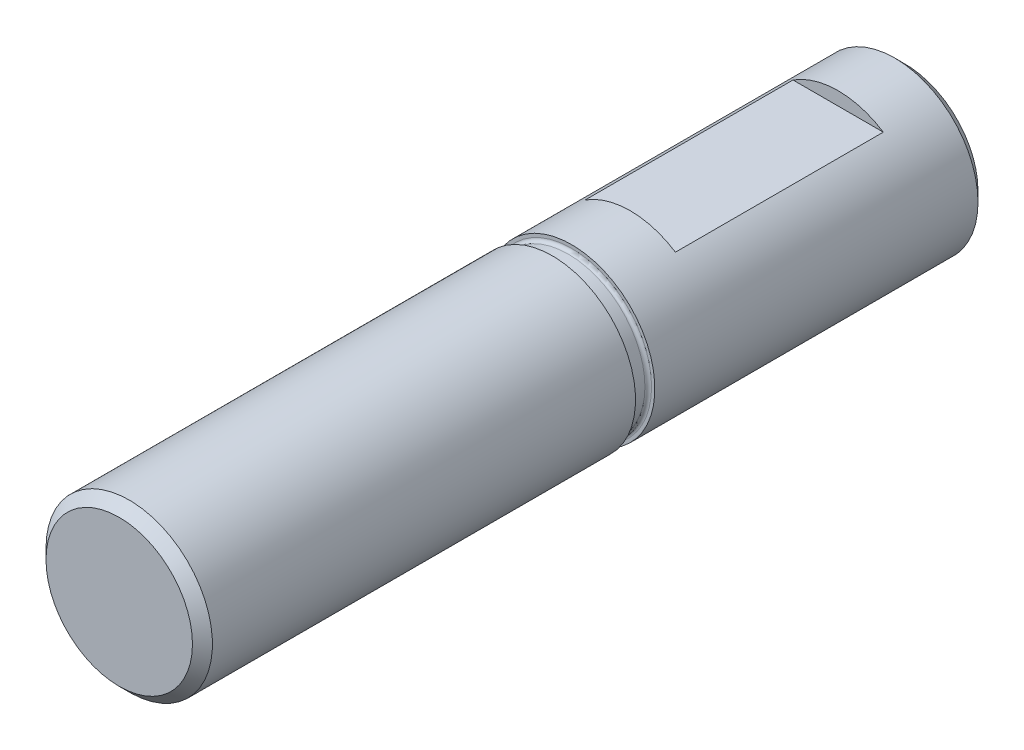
SolidWorks part; units mm, degrees
ref_plane "Front" through (0, 0, 0) normal (0, 0, 1) x (1, 0, 0)
ref_plane "Top" through (0, 0, 0) normal (0, 1, 0) x (1, 0, 0)
ref_plane "Right" through (0, 0, 0) normal (1, 0, 0) x (0, 0, -1)
sketch "Sketch1" plane through (0, 0, 0) normal (0, 0, 1) x (1, 0, 0)
  circle A0 centre (0, 0) radius 3.1725
  dimension "Diam" = 6.3449
extrude "Base-Extrude" add sketch "Sketch1" along normal blind 29.9466
sketch "Sketch2" plane through (0, 0, 0) normal (0, 1, 0) x (1, 0, 0)
  line L0 (3.1725, -29.9466) -> (3.1725, 0) construction
  line L1 (3.1725, -12.7) -> (2.921, -12.7)
  line L2 (3.1725, -12.7) -> (3.1725, -13.4366)
  line L3 (3.1725, -13.4366) -> (2.921, -13.4366)
  line L4 (2.921, -12.7) -> (2.921, -13.4366)
  line L6 (3.1725, 0) -> (-3.1725, 0) construction
  line L7 (0, 0) -> (0, -25.4) construction
  line L8 (0, -29.9466) -> (0, 0) construction
  dimension "Radius" = 2.921
  dimension "D2" = 0.7366
  dimension "Len" = 12.7
revolve "Cut-Revolve1" cut sketch "Sketch2" angle 360 about L7
fillet "Fillet1" radius 0.127 2 edges at (-2.921, 0, 13.4366) (-2.921, 0, 12.7)
sketch "Sketch3" plane through (0, 0, 0) normal (1, 0, 0) x (0, 0, -1)
  line L0 (-10.4648, 3.9345) -> (-10.4648, 2.6645)
  line L1 (-10.4648, 2.6645) -> (-2.54, 2.6645)
  line L2 (-2.54, 2.6645) -> (-2.54, 3.9345)
  line L3 (-2.54, 3.9345) -> (-10.4648, 3.9345)
  line L4 (0, 3.1725) -> (-12.7, 3.1725) construction
  line L5 (0, -3.1725) -> (0, 3.1725) construction
  dimension "D1" = 0.508
  dimension "D2" = 2.54
  dimension "D3" = 7.9248
  dimension "D4" = 1.27
extrude "Cut-Extrude1" cut sketch "Sketch3" against normal mid plane 5.08
chamfer "Chamfer1" distance 0.381 angle 45 2 edges at (3.1725, 0, 0) (3.1725, 0, 29.9466)
